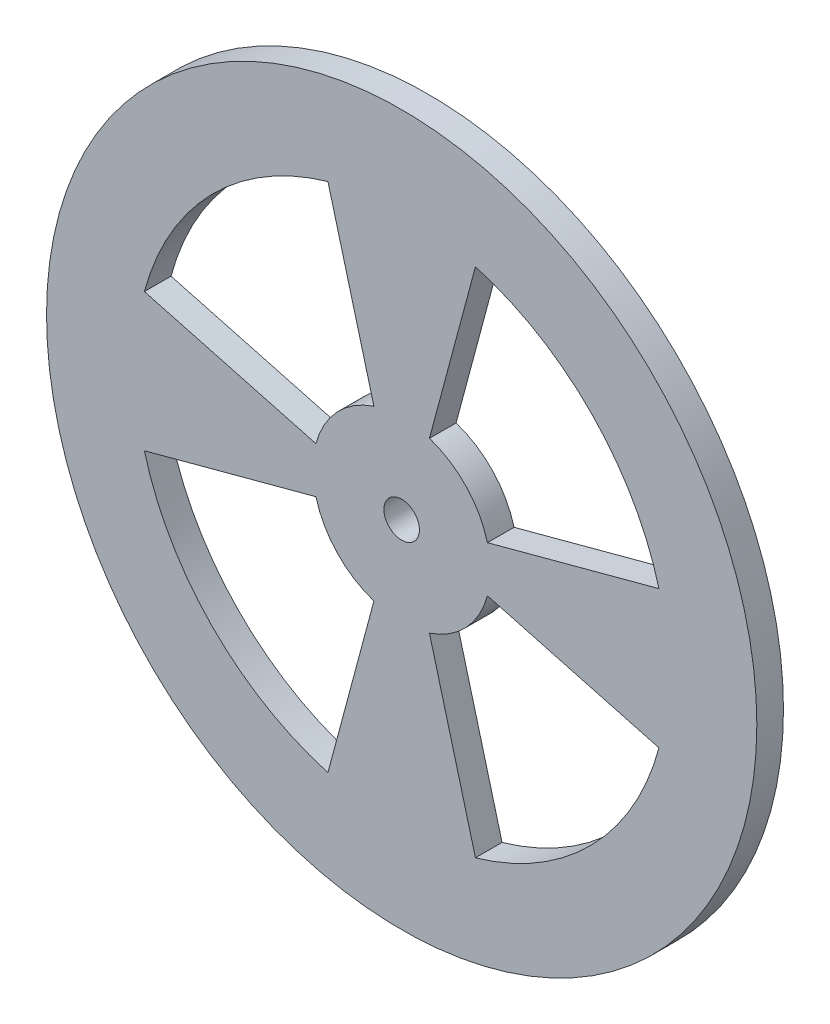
SolidWorks part; units mm, degrees
ref_plane "Plan de face" through (0, 0, 0) normal (0, 0, 1) x (1, 0, 0)
ref_plane "Plan de dessus" through (0, 0, 0) normal (0, 1, 0) x (1, 0, 0)
ref_plane "Plan de droite" through (0, 0, 0) normal (1, 0, 0) x (0, 0, -1)
sketch "Esquisse1" plane through (0, 0, 0) normal (0, 0, 1) x (1, 0, 0)
  line L0 (0, 0) -> (-29.4323, 0) construction
  line L1 (0, 0) -> (0, 24.3094) construction
  line L2 (-8.3068, 28.827) -> (-3.1277, 9.4983)
  line L3 (-9.6593, 2.5882) -> (-28.9778, 7.7646)
  line L4 (-8.3068, -28.827) -> (-3.1277, -9.4983)
  line L5 (-9.6593, -2.5882) -> (-28.9778, -7.7646)
  line L6 (8.3068, 28.827) -> (3.1277, 9.4983)
  line L7 (9.6593, 2.5882) -> (28.9778, 7.7646)
  line L8 (9.6593, -2.5882) -> (28.9778, -7.7646)
  line L9 (8.3068, -28.827) -> (3.1277, -9.4983)
  circle A0 centre (0, 0) radius 40
  circle A1 centre (0, 0) radius 2
  circle A2 centre (0, 0) radius 30
  circle A3 centre (0, 0) radius 10
  dimension "D1" = 80
  dimension "D2" = 4
  dimension "D3" = 10
  dimension "D6" = 20
  dimension "D4" = 15
  dimension "D5" = 15
extrude "Boss.-Extru.1" add sketch "Esquisse1" along normal blind 3 contours A3 L6 A2 L2 | A3 A1 | A3 L8 A2 L7 | A3 L4 A2 L9 | A0 A2 | A3 L3 A2 L5
